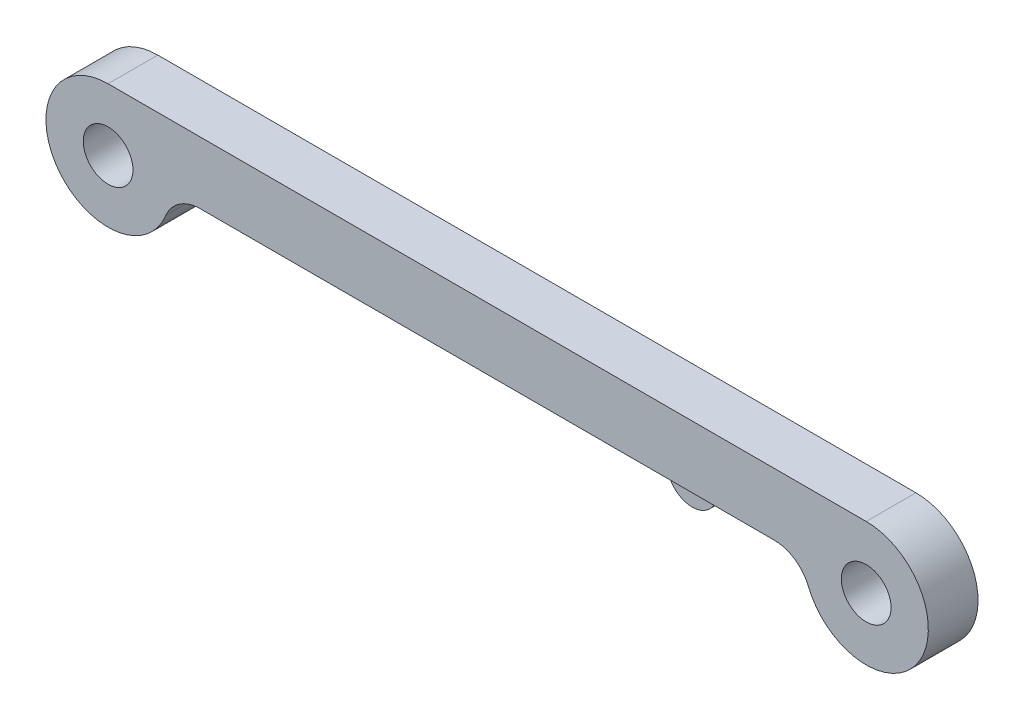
SolidWorks part; units mm, degrees
ref_plane "Front" through (0, 0, 0) normal (0, 0, 1) x (1, 0, 0)
ref_plane "Top" through (0, 0, 0) normal (0, 1, 0) x (1, 0, 0)
ref_plane "Right" through (0, 0, 0) normal (1, 0, 0) x (0, 0, -1)
sketch "Sketch1" plane through (0, 0, 0) normal (0, 0, 1) x (1, 0, 0)
  line L0 (-63.2211, 4.5) -> (-2.2211, 4.5)
  line L1 (-55.8049, -0.5) -> (-9.6373, -0.5)
  circle A0 centre (-63.2211, -0.5) radius 2
  circle A1 centre (-2.2211, -0.5) radius 2
  arc A2 (-63.2211, 4.5) -> (-58.586, -2.375) centre (-63.2211, -0.5) ccw
  arc A3 (-6.8563, -2.375) -> (-2.2211, 4.5) centre (-2.2211, -0.5) ccw
  arc A4 (-55.8049, -0.5) -> (-58.586, -2.375) centre (-55.8049, -3.5) ccw
  circle A5 centre (-63.2211, -0.5) radius 5 construction
  circle A6 centre (-2.2211, -0.5) radius 5 construction
  arc A7 (-9.6373, -0.5) -> (-6.8563, -2.375) centre (-9.6373, -3.5) cw
  point P5 (-6.7211, 0)
  point P12 (-58.7211, 0)
  point P16 (-58.2211, -0.5)
  dimension "D2" = 4
  dimension "D3" = 4
  dimension "D6" = 3
  dimension "D7" = 3
  dimension "D1" = 61
  dimension "D4" = 3
  dimension "D5" = 3
extrude "Boss-Extrude1" add sketch "Sketch1" along normal blind 4
sketch "Sketch3" plane through (0, 0, 4) normal (0, 0, 1) x (1, 0, 0)
  line L0 (-55.8049, -0.5) -> (-9.6373, -0.5) construction
  circle A0 centre (-17.2211, -0.5) radius 1
  circle A1 centre (-17.2211, -0.5) radius 2
  circle A2 centre (-2.2211, -0.5) radius 2 construction
  dimension "D1" = 2
  dimension "D2" = 4
  dimension "D3" = 15
extrude "Boss-Extrude3" add sketch "Sketch3" against normal blind 2 from offset 1
fillet "Fillet1" radius 1 2 edges at (-19.2211, -0.5, 2) (-15.2211, -0.5, 2)
